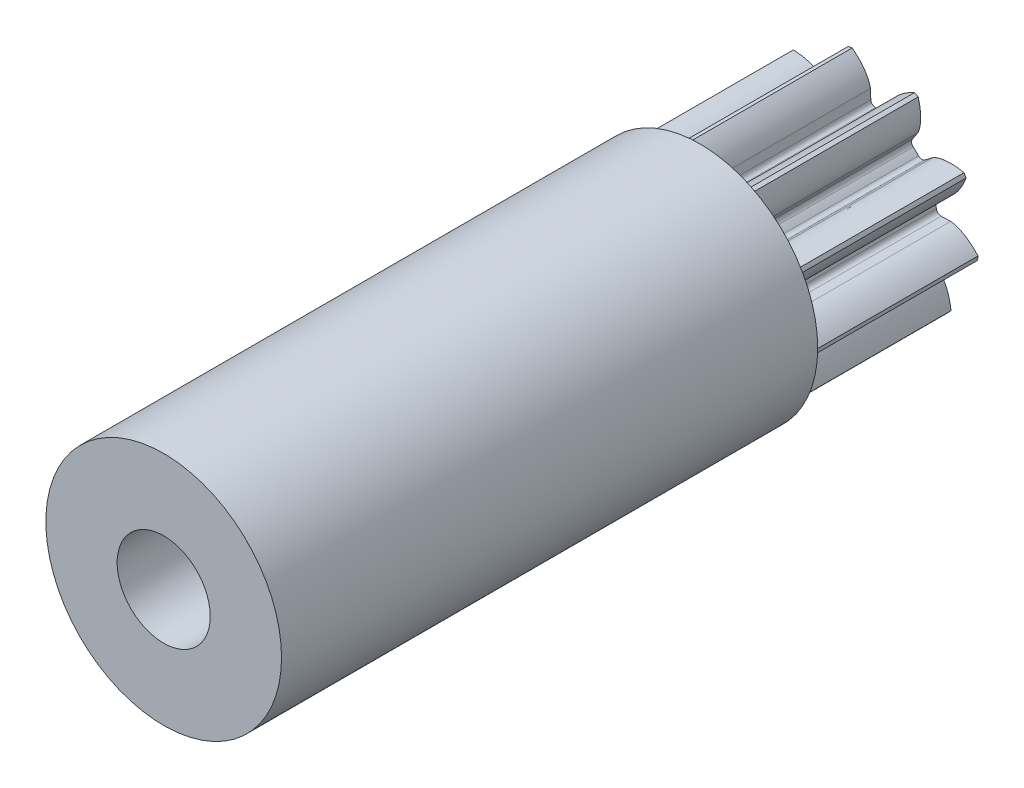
SolidWorks part; units mm, degrees
ref_plane "Plan de face" through (0, 0, 0) normal (0, 0, 1) x (1, 0, 0)
ref_plane "Plan de dessus" through (0, 0, 0) normal (0, 1, 0) x (1, 0, 0)
ref_plane "Plan de droite" through (0, 0, 0) normal (1, 0, 0) x (0, 0, -1)
sketch "Esquisse1" plane through (0, 0, 0) normal (0, 1, 0) x (1, 0, 0)
  line L0 (1, -6.35) -> (0, -6.35)
  line L1 (0, -6.35) -> (0, -10.9)
  line L2 (0, -10.9) -> (1, -10.9)
  line L3 (1, -10.9) -> (1, -6.35)
  line L4 (0, -6.35) -> (0, -10.9) construction
revolve "Révolution1" add sketch "Esquisse1" angle 360 about L4
sketch "Esquisse2" plane through (0, 0, 6.35) normal (0, 0, -1) x (-1, 0, 0)
  line L0 (0.0024, -0.5625) -> (-0.0032, -0.6797)
  line L1 (-0.2514, -0.6316) -> (-0.2126, -0.5208)
  line L2 (-0.3287, -0.4565) -> (-0.4021, -0.5481)
  line L3 (-0.5746, -0.3632) -> (-0.4781, -0.2963)
  line L4 (-0.5342, -0.1761) -> (-0.6474, -0.207)
  line L5 (-0.6783, 0.0439) -> (-0.561, 0.0413)
  line L6 (-0.5357, 0.1715) -> (-0.6455, 0.213)
  line L7 (-0.523, 0.4342) -> (-0.4296, 0.3632)
  line L8 (-0.3326, 0.4537) -> (-0.397, 0.5518)
  line L9 (-0.1679, 0.6587) -> (-0.1341, 0.5463)
  line L10 (-0.0024, 0.5625) -> (0.0032, 0.6797)
  line L11 (0.2514, 0.6316) -> (0.2126, 0.5208)
  line L12 (0.3287, 0.4565) -> (0.4021, 0.5481)
  line L13 (0.5746, 0.3632) -> (0.4781, 0.2963)
  line L14 (0.5342, 0.1761) -> (0.6474, 0.207)
  line L15 (0.6783, -0.0439) -> (0.561, -0.0413)
  line L16 (0.5357, -0.1715) -> (0.6455, -0.213)
  line L17 (0.523, -0.4342) -> (0.4296, -0.3632)
  line L18 (0.3326, -0.4537) -> (0.397, -0.5518)
  line L19 (0.1679, -0.6587) -> (0.1341, -0.5463)
  arc A0 (0.1341, -0.5463) -> (0.0024, -0.5625) centre (0, 0) cw
  arc A1 (-0.157, -0.9014) -> (-0.1917, -0.8947) centre (0, 0) cw
  arc A2 (-0.2126, -0.5208) -> (-0.3287, -0.4565) centre (0, 0) cw
  arc A3 (-0.6568, -0.637) -> (-0.6809, -0.6112) centre (0, 0) cw
  arc A4 (-0.4781, -0.2963) -> (-0.5342, -0.1761) centre (0, 0) cw
  arc A5 (-0.9058, -0.1293) -> (-0.9101, -0.0942) centre (0, 0) cw
  arc A6 (-0.561, 0.0413) -> (-0.5357, 0.1715) centre (0, 0) cw
  arc A7 (-0.8088, 0.4278) -> (-0.7917, 0.4588) centre (0, 0) cw
  arc A8 (-0.4296, 0.3632) -> (-0.3326, 0.4537) centre (0, 0) cw
  arc A9 (-0.4029, 0.8215) -> (-0.3708, 0.8365) centre (0, 0) cw
  arc A10 (-0.1341, 0.5463) -> (-0.0024, 0.5625) centre (0, 0) cw
  arc A11 (0.157, 0.9014) -> (0.1917, 0.8947) centre (0, 0) cw
  arc A12 (0.2126, 0.5208) -> (0.3287, 0.4565) centre (0, 0) cw
  arc A13 (0.6568, 0.637) -> (0.6809, 0.6112) centre (0, 0) cw
  arc A14 (0.4781, 0.2963) -> (0.5342, 0.1761) centre (0, 0) cw
  arc A15 (0.9058, 0.1293) -> (0.9101, 0.0942) centre (0, 0) cw
  arc A16 (0.561, -0.0413) -> (0.5357, -0.1715) centre (0, 0) cw
  arc A17 (0.8088, -0.4278) -> (0.7917, -0.4588) centre (0, 0) cw
  arc A18 (0.4296, -0.3632) -> (0.3326, -0.4537) centre (0, 0) cw
  arc A19 (0.4029, -0.8215) -> (0.3708, -0.8365) centre (0, 0) cw
  spline S0 degree 3 poles (-0.0032, -0.6797) (-0.0038, -0.6934) (-0.0081, -0.7069) (-0.0128, -0.7198) (-0.0255, -0.7544) (-0.0458, -0.7862) (-0.0687, -0.815) (-0.0944, -0.8472) (-0.1246, -0.876) (-0.157, -0.9014) knots 0 0 0 0 0.000041 0.000041 0.000041 0.000153 0.000153 0.000153 0.000277 0.000277 0.000277 0.000277
  spline S1 degree 3 poles (-0.1917, -0.8947) (-0.2044, -0.8725) (-0.2159, -0.8495) (-0.2256, -0.8258) (-0.2352, -0.8022) (-0.2431, -0.7776) (-0.2487, -0.7527) (-0.2542, -0.7284) (-0.2576, -0.7034) (-0.2575, -0.6785) (-0.2574, -0.6627) (-0.2566, -0.6464) (-0.2514, -0.6316) knots 0 0 0 0 0.000077 0.000077 0.000077 0.000154 0.000154 0.000154 0.000228 0.000228 0.000228 0.000276 0.000276 0.000276 0.000276
  spline S2 degree 3 poles (-0.4021, -0.5481) (-0.4107, -0.5588) (-0.4221, -0.5671) (-0.4335, -0.5748) (-0.464, -0.5953) (-0.4992, -0.6092) (-0.5347, -0.619) (-0.5743, -0.63) (-0.6157, -0.6355) (-0.6568, -0.637) knots 0 0 0 0 0.000041 0.000041 0.000041 0.000153 0.000153 0.000153 0.000277 0.000277 0.000277 0.000277
  spline S3 degree 3 poles (-0.6809, -0.6112) (-0.6782, -0.5857) (-0.674, -0.5604) (-0.6679, -0.5355) (-0.6618, -0.5107) (-0.6538, -0.4862) (-0.6436, -0.4628) (-0.6338, -0.4399) (-0.6219, -0.4176) (-0.6071, -0.3976) (-0.5977, -0.3848) (-0.5875, -0.3722) (-0.5746, -0.3632) knots 0 0 0 0 0.000077 0.000077 0.000077 0.000154 0.000154 0.000154 0.000228 0.000228 0.000228 0.000276 0.000276 0.000276 0.000276
  spline S4 degree 3 poles (-0.6474, -0.207) (-0.6607, -0.2107) (-0.6748, -0.2107) (-0.6885, -0.2102) (-0.7253, -0.2088) (-0.7619, -0.1994) (-0.7964, -0.1865) (-0.8349, -0.1721) (-0.8717, -0.1522) (-0.9058, -0.1293) knots 0 0 0 0 0.000041 0.000041 0.000041 0.000153 0.000153 0.000153 0.000277 0.000277 0.000277 0.000277
  spline S5 degree 3 poles (-0.9101, -0.0942) (-0.893, -0.0752) (-0.8747, -0.0572) (-0.8551, -0.0407) (-0.8356, -0.0242) (-0.8147, -0.0091) (-0.7927, 0.0039) (-0.7713, 0.0166) (-0.7486, 0.0277) (-0.7248, 0.0352) (-0.7098, 0.04) (-0.6941, 0.0442) (-0.6783, 0.0439) knots 0 0 0 0 0.000077 0.000077 0.000077 0.000154 0.000154 0.000154 0.000228 0.000228 0.000228 0.000276 0.000276 0.000276 0.000276
  spline S6 degree 3 poles (-0.6455, 0.213) (-0.6583, 0.2179) (-0.6698, 0.2261) (-0.6806, 0.2346) (-0.7095, 0.2574) (-0.7336, 0.2865) (-0.7539, 0.3172) (-0.7766, 0.3516) (-0.7947, 0.3892) (-0.8088, 0.4278) knots 0 0 0 0 0.000041 0.000041 0.000041 0.000153 0.000153 0.000153 0.000277 0.000277 0.000277 0.000277
  spline S7 degree 3 poles (-0.7917, 0.4588) (-0.7667, 0.464) (-0.7412, 0.4678) (-0.7157, 0.4697) (-0.6902, 0.4716) (-0.6645, 0.4715) (-0.639, 0.4691) (-0.6142, 0.4668) (-0.5893, 0.4624) (-0.5657, 0.4545) (-0.5507, 0.4496) (-0.5355, 0.4438) (-0.523, 0.4342) knots 0 0 0 0 0.000077 0.000077 0.000077 0.000154 0.000154 0.000154 0.000228 0.000228 0.000228 0.000276 0.000276 0.000276 0.000276
  spline S8 degree 3 poles (-0.397, 0.5518) (-0.4045, 0.5632) (-0.4089, 0.5767) (-0.4127, 0.5899) (-0.4228, 0.6253) (-0.4251, 0.663) (-0.4235, 0.6998) (-0.4216, 0.7409) (-0.4141, 0.7819) (-0.4029, 0.8215) knots 0 0 0 0 0.000041 0.000041 0.000041 0.000153 0.000153 0.000153 0.000277 0.000277 0.000277 0.000277
  spline S9 degree 3 poles (-0.3708, 0.8365) (-0.3475, 0.826) (-0.3247, 0.8142) (-0.3029, 0.8007) (-0.2812, 0.7872) (-0.2604, 0.772) (-0.2412, 0.7551) (-0.2225, 0.7387) (-0.205, 0.7205) (-0.1905, 0.7002) (-0.1813, 0.6874) (-0.1724, 0.6738) (-0.1679, 0.6587) knots 0 0 0 0 0.000077 0.000077 0.000077 0.000154 0.000154 0.000154 0.000228 0.000228 0.000228 0.000276 0.000276 0.000276 0.000276
  spline S10 degree 3 poles (0.0032, 0.6797) (0.0038, 0.6934) (0.0081, 0.7069) (0.0128, 0.7198) (0.0255, 0.7544) (0.0458, 0.7862) (0.0687, 0.815) (0.0944, 0.8472) (0.1246, 0.876) (0.157, 0.9014) knots 0 0 0 0 0.000041 0.000041 0.000041 0.000153 0.000153 0.000153 0.000277 0.000277 0.000277 0.000277
  spline S11 degree 3 poles (0.1917, 0.8947) (0.2044, 0.8725) (0.2159, 0.8495) (0.2256, 0.8258) (0.2352, 0.8022) (0.2431, 0.7776) (0.2487, 0.7527) (0.2542, 0.7284) (0.2576, 0.7034) (0.2575, 0.6785) (0.2574, 0.6627) (0.2566, 0.6464) (0.2514, 0.6316) knots 0 0 0 0 0.000077 0.000077 0.000077 0.000154 0.000154 0.000154 0.000228 0.000228 0.000228 0.000276 0.000276 0.000276 0.000276
  spline S12 degree 3 poles (0.4021, 0.5481) (0.4107, 0.5588) (0.4221, 0.5671) (0.4335, 0.5748) (0.464, 0.5953) (0.4992, 0.6092) (0.5347, 0.619) (0.5743, 0.63) (0.6157, 0.6355) (0.6568, 0.637) knots 0 0 0 0 0.000041 0.000041 0.000041 0.000153 0.000153 0.000153 0.000277 0.000277 0.000277 0.000277
  spline S13 degree 3 poles (0.6809, 0.6112) (0.6782, 0.5857) (0.674, 0.5604) (0.6679, 0.5355) (0.6618, 0.5107) (0.6538, 0.4862) (0.6436, 0.4628) (0.6338, 0.4399) (0.6219, 0.4176) (0.6071, 0.3976) (0.5977, 0.3848) (0.5875, 0.3722) (0.5746, 0.3632) knots 0 0 0 0 0.000077 0.000077 0.000077 0.000154 0.000154 0.000154 0.000228 0.000228 0.000228 0.000276 0.000276 0.000276 0.000276
  spline S14 degree 3 poles (0.6474, 0.207) (0.6607, 0.2107) (0.6748, 0.2107) (0.6885, 0.2102) (0.7253, 0.2088) (0.7619, 0.1994) (0.7964, 0.1865) (0.8349, 0.1721) (0.8717, 0.1522) (0.9058, 0.1293) knots 0 0 0 0 0.000041 0.000041 0.000041 0.000153 0.000153 0.000153 0.000277 0.000277 0.000277 0.000277
  spline S15 degree 3 poles (0.9101, 0.0942) (0.893, 0.0752) (0.8747, 0.0572) (0.8551, 0.0407) (0.8356, 0.0242) (0.8147, 0.0091) (0.7927, -0.0039) (0.7713, -0.0166) (0.7486, -0.0277) (0.7248, -0.0352) (0.7098, -0.04) (0.6941, -0.0442) (0.6783, -0.0439) knots 0 0 0 0 0.000077 0.000077 0.000077 0.000154 0.000154 0.000154 0.000228 0.000228 0.000228 0.000276 0.000276 0.000276 0.000276
  spline S16 degree 3 poles (0.6455, -0.213) (0.6583, -0.2179) (0.6698, -0.2261) (0.6806, -0.2346) (0.7095, -0.2574) (0.7336, -0.2865) (0.7539, -0.3172) (0.7766, -0.3516) (0.7947, -0.3892) (0.8088, -0.4278) knots 0 0 0 0 0.000041 0.000041 0.000041 0.000153 0.000153 0.000153 0.000277 0.000277 0.000277 0.000277
  spline S17 degree 3 poles (0.7917, -0.4588) (0.7667, -0.464) (0.7412, -0.4678) (0.7157, -0.4697) (0.6902, -0.4716) (0.6645, -0.4715) (0.639, -0.4691) (0.6142, -0.4668) (0.5893, -0.4624) (0.5657, -0.4545) (0.5507, -0.4496) (0.5355, -0.4438) (0.523, -0.4342) knots 0 0 0 0 0.000077 0.000077 0.000077 0.000154 0.000154 0.000154 0.000228 0.000228 0.000228 0.000276 0.000276 0.000276 0.000276
  spline S18 degree 3 poles (0.397, -0.5518) (0.4045, -0.5632) (0.4089, -0.5767) (0.4127, -0.5899) (0.4228, -0.6253) (0.4251, -0.663) (0.4235, -0.6998) (0.4216, -0.7409) (0.4141, -0.7819) (0.4029, -0.8215) knots 0 0 0 0 0.000041 0.000041 0.000041 0.000153 0.000153 0.000153 0.000277 0.000277 0.000277 0.000277
  spline S19 degree 3 poles (0.3708, -0.8365) (0.3475, -0.826) (0.3247, -0.8142) (0.3029, -0.8007) (0.2812, -0.7872) (0.2604, -0.772) (0.2412, -0.7551) (0.2225, -0.7387) (0.205, -0.7205) (0.1905, -0.7002) (0.1813, -0.6874) (0.1724, -0.6738) (0.1679, -0.6587) knots 0 0 0 0 0.000077 0.000077 0.000077 0.000154 0.000154 0.000154 0.000228 0.000228 0.000228 0.000276 0.000276 0.000276 0.000276
extrude "Boss.-Extru.1" add sketch "Esquisse2" along normal blind 1.45
hole_wizard "Perçage1" positions "Esquisse4" profile "Esquisse3" legacy
sketch "Esquisse4" plane through (0, 0, 10.9) normal (0, 0, 1) x (1, 0, 0)
  point P0 (0, 0)
sketch "Esquisse3" plane through (0, 0, 10.9) normal (1, 0, 0) x (0, -1, 0)
  line L0 (0, 0) -> (0, 4.2)
  line L1 (0, 4.2) -> (0.395, 4.2)
  line L2 (0.395, 4.2) -> (0.395, 0)
  line L3 (0.395, 0) -> (0, 0)
  line L4 (0, 110) -> (0, -10) construction
  dimension "Diamètre" = 0.79
  dimension "Profondeur" = 4.2
fillet "Congé1" radius 0.04 18 edges at (-0.0024, -0.5625, 5.625) (0.3287, -0.4565, 5.625) (0.4781, -0.2963, 5.625) (0.3326, 0.4537, 5.625) (0.2126, -0.5208, 5.625) (0.4296, 0.3632, 5.625) (0.1341, 0.5463, 5.625) (-0.2126, 0.5208, 5.625) (-0.5357, -0.1715, 5.625) (-0.3287, 0.4565, 5.625) (-0.4296, -0.3632, 5.625) (0.5357, 0.1715, 5.625) (0.0024, 0.5625, 5.625) (-0.3326, -0.4537, 5.625) (0.561, 0.0413, 5.625) (-0.1341, -0.5463, 5.625) (-0.4781, 0.2963, 5.625) (0.5342, -0.1761, 5.625)
fillet "Congé2" radius 0.2 1 edges at (0.395, 0, 6.7)
